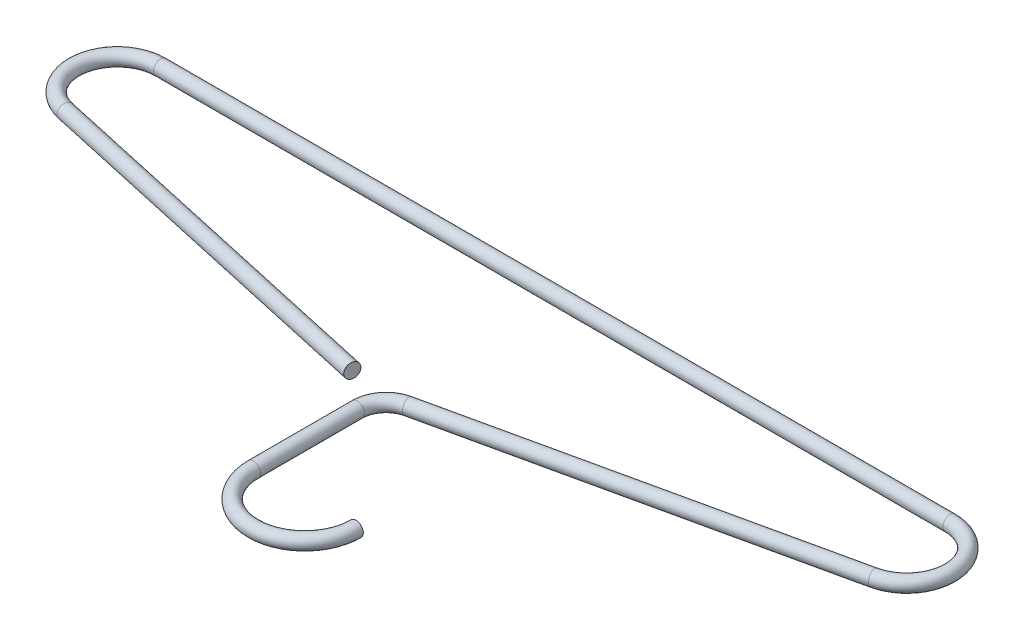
SolidWorks part; units mm, degrees
ref_plane "Front" through (0, 0, 0) normal (0, 0, 1) x (1, 0, 0)
ref_plane "Top" through (0, 0, 0) normal (0, 1, 0) x (1, 0, 0)
ref_plane "Right" through (0, 0, 0) normal (1, 0, 0) x (0, 0, -1)
sketch "Sketch1" plane through (0, 0, 0) normal (0, -1, 0) x (1, 0, 0)
  line L0 (0, 55.1092) -> (0, 9.3984)
  line L1 (9.9572, -3.0019) -> (177.8074, -40.1285)
  line L2 (173.6932, -77.7789) -> (-173.6932, -77.7789)
  line L3 (0, 55.1092) -> (0, -137.465) construction
  line L4 (-177.8074, -40.1285) -> (-15.8778, -4.3114)
  arc A0 (45.217, 55.1092) -> (0, 55.1092) centre (22.6085, 55.1092) ccw
  arc A1 (177.8074, -40.1285) -> (173.6932, -77.7789) centre (173.6932, -58.7289) cw
  arc A2 (9.9572, -3.0019) -> (0, 9.3984) centre (12.7, 9.3984) cw
  arc A3 (-177.8074, -40.1285) -> (-173.6932, -77.7789) centre (-173.6932, -58.7289) ccw
  point P14 (0, 0)
  dimension "D1" = 12.7
  dimension "D2" = 19.05
ref_plane "Plane4" through (-15.8778, 0, -4.3114) normal (0.9764, 0, 0.216) x (0.2159, 0.0239, -0.9761)
sketch "Sketch2" plane through (-15.8778, 0, -4.3114) normal (0.9764, 0, 0.216) x (0.2159, 0.0239, -0.9761)
  circle A0 centre (0, 0) radius 3.175
  dimension "D1" = 6.35
sweep "Sweep1" add profiles "Sketch2" path "Sketch1"
